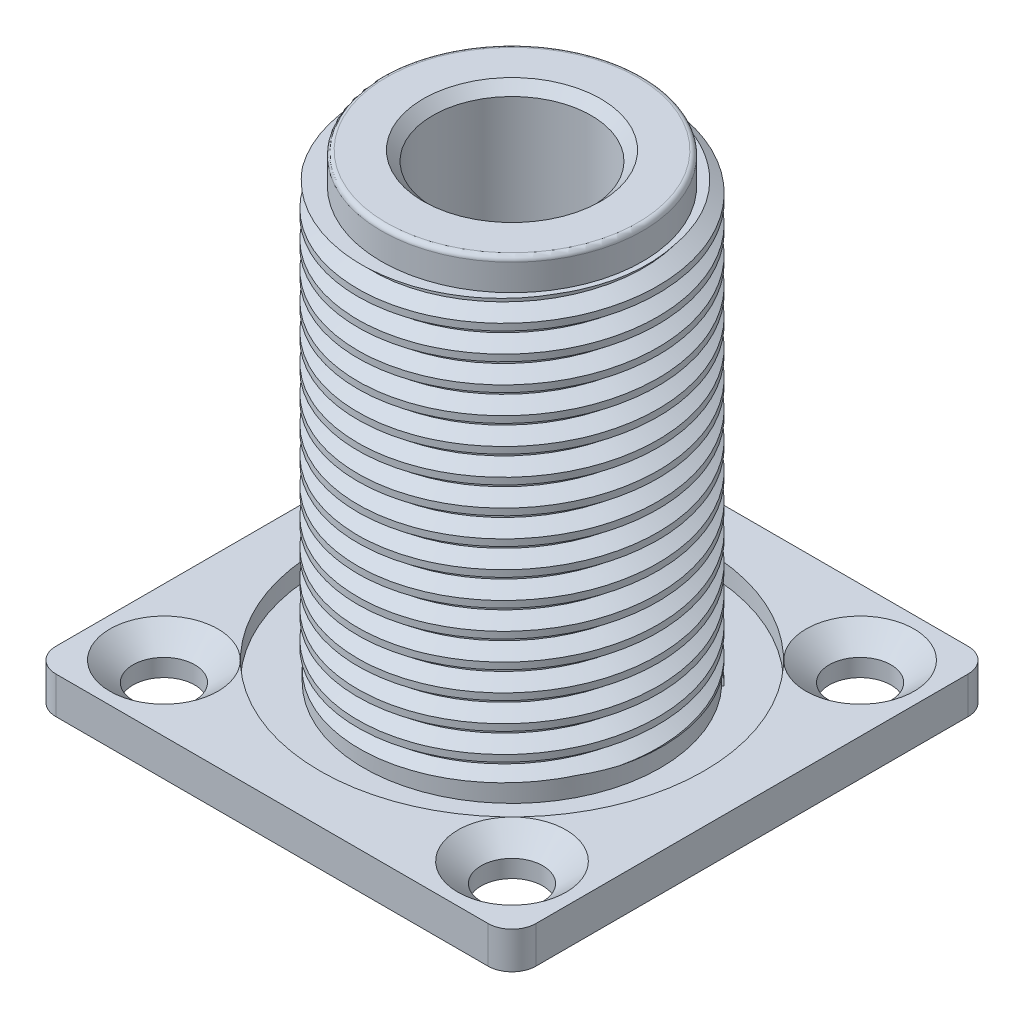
SolidWorks part; units mm, degrees
ref_plane "Front Plane" through (0, 0, 0) normal (0, 0, 1) x (1, 0, 0)
ref_plane "Top Plane" through (0, 0, 0) normal (0, 1, 0) x (1, 0, 0)
ref_plane "Right Plane" through (0, 0, 0) normal (1, 0, 0) x (0, 0, -1)
sketch "Sketch1" plane through (0, 0, 0) normal (0, 1, 0) x (1, 0, 0)
  line L1 (-12.7, 12.7) -> (12.7, 12.7)
  line L2 (-12.7, 12.7) -> (-12.7, -12.7)
  line L3 (-12.7, -12.7) -> (12.7, -12.7)
  line L4 (12.7, 12.7) -> (12.7, -12.7)
  line L5 (-12.7, 12.7) -> (12.7, -12.7) construction
  line L6 (-12.7, -12.7) -> (12.7, 12.7) construction
  point P0 (0, 0)
extrude "Boss-Extrude1" add sketch "Sketch1" along normal blind 1.9558
sketch "Sketch2" plane through (0, 1.9558, 0) normal (0, 1, 0) x (1, 0, 0)
  line L1 (-9.2075, -9.2075) -> (9.2075, -9.2075) construction
  line L2 (-9.2075, -9.2075) -> (-9.2075, 9.2075) construction
  line L3 (-9.2075, 9.2075) -> (9.2075, 9.2075) construction
  line L4 (9.2075, -9.2075) -> (9.2075, 9.2075) construction
  line L5 (-9.2075, -9.2075) -> (9.2075, 9.2075) construction
  line L6 (-9.2075, 9.2075) -> (9.2075, -9.2075) construction
  circle A0 centre (-9.2075, 9.2075) radius 1.59
  circle A1 centre (9.2075, 9.2075) radius 1.5875
  circle A2 centre (9.2075, -9.2075) radius 1.5875
  circle A3 centre (-9.2075, -9.2075) radius 1.5875
  point P0 (0, 0)
extrude "Cut-Extrude1" cut sketch "Sketch2" against normal blind 1.9558
fillet "Fillet1" radius 1.27 4 edges at (12.7, 0.9779, 12.7) (-12.7, 0.9779, 12.7) (12.7, 0.9779, -12.7) (-12.7, 0.9779, -12.7)
sketch "Sketch3" plane through (0, 1.9558, 0) normal (0, 1, 0) x (1, 0, 0)
  circle A0 centre (0, 0) radius 7.9375
extrude "Boss-Extrude2" add sketch "Sketch3" along normal blind 23.368
sketch "Sketch4" plane through (0, 25.3238, 0) normal (0, 1, 0) x (1, 0, 0)
  circle A0 centre (0, 0) radius 6.9088
extrude "Cut-Extrude2" cut sketch "Sketch4" against normal blind 1.651 flip side to cut contours A0
sketch "Sketch5" plane through (0, 25.3238, 0) normal (0, 1, 0) x (1, 0, 0)
  circle A0 centre (0, 0) radius 4.191
extrude "Cut-Extrude3" cut sketch "Sketch5" against normal blind 9.271 contours A0
chamfer "Chamfer1" distance 0.508 angle 45 1 edges at (0, 25.3238, 4.191)
fillet "Fillet2" radius 0.254 1 edges at (0, 25.3238, 6.9088)
thread "Thread2" pitch 1.4111 start angle 0, offset 1.27, length 23.114, pitch 1.4111, diameter 15.875
ref_plane "Plane3" through (-7.9375, 24.9428, 0) normal (0, 0, -1) x (1, 0, 0)
sketch "Thread Profile3" plane through (-7.9375, 24.9428, 0) normal (0, 0, -1) x (1, 0, 0)
  line L0 (0, 0) -> (0, 1.4111) construction
  line L1 (0, 0) -> (0.7638, 0.441)
  line L2 (0.7638, 0.441) -> (0.7638, 0.6174)
  line L3 (0.7638, 0.6174) -> (0, 1.0583)
  line L4 (0.7638, 0.5292) -> (0, 0.5292) construction
  line L11 (0, 0) -> (0, 1.0583)
  point P2 (0, 0)
  dimension "Pitch" = 1.4111
  dimension "Profile_Angle" = 60
  dimension "Profile_Land" = 0.1764
  dimension "Profile_Height" = 0.7638
sketch "Sketch6" plane through (0, 1.9558, 0) normal (0, 1, 0) x (1, 0, 0)
  circle A0 centre (0, 0) radius 10.16
  circle A1 centre (0, 0) radius 7.8486
extrude "Cut-Extrude4" cut sketch "Sketch6" against normal blind 1.016
hole_wizard "CSK for #4 Flat Head Machine Screw (100)1" positions "Sketch7" profile "Sketch8" countersink size "#4" standard "ANSI Inch"
sketch "Sketch7" plane through (0, 1.9558, 0) normal (0, 1, 0) x (1, 0, 0)
  point P0 (-9.2075, 9.2075)
  point P3 (9.2075, 9.2075)
  point P6 (9.2075, -9.2075)
  point P9 (-9.2075, -9.2075)
sketch "Sketch8" plane through (-9.2075, 1.9558, -9.2075) normal (1, 0, 0) x (0, 0, 1)
  line L0 (0, 0) -> (0, 1.9558)
  line L1 (0, 1.9558) -> (1.6319, 1.9558)
  line L2 (1.6319, 1.9558) -> (1.632, 1.0284)
  line L3 (1.632, 1.0284) -> (2.8575, 0)
  line L5 (2.8575, 0) -> (0, 0)
  line L6 (-1.632, 1.0284) -> (-2.8575, 0) construction
  line L11 (0, -6.35) -> (0, 107.95) construction
  dimension "Thru Hole Dia." = 3.2639
  dimension "Thru Hole Depth" = 1.9558
  dimension "Near C'Sink Dia." = 5.715
  dimension "Near C'Sink Angle" = 100
sketch "Sketch9" plane through (0, 0, 0) normal (0, -1, 0) x (1, 0, 0)
  circle A0 centre (0, 0) radius 6.0198
extrude "Boss-Extrude3" add sketch "Sketch9" along normal blind 0.254
sketch "Sketch10" plane through (0, -0.254, 0) normal (0, -1, 0) x (1, 0, 0)
  circle A0 centre (0, 0) radius 5.08
extrude "Cut-Extrude5" cut sketch "Sketch10" against normal blind 0.254
sketch "Sketch11" plane through (0, 0, 0) normal (0, -1, 0) x (1, 0, 0)
  circle A0 centre (0, 0) radius 1.651
extrude "Cut-Extrude6" cut sketch "Sketch11" against normal through all
